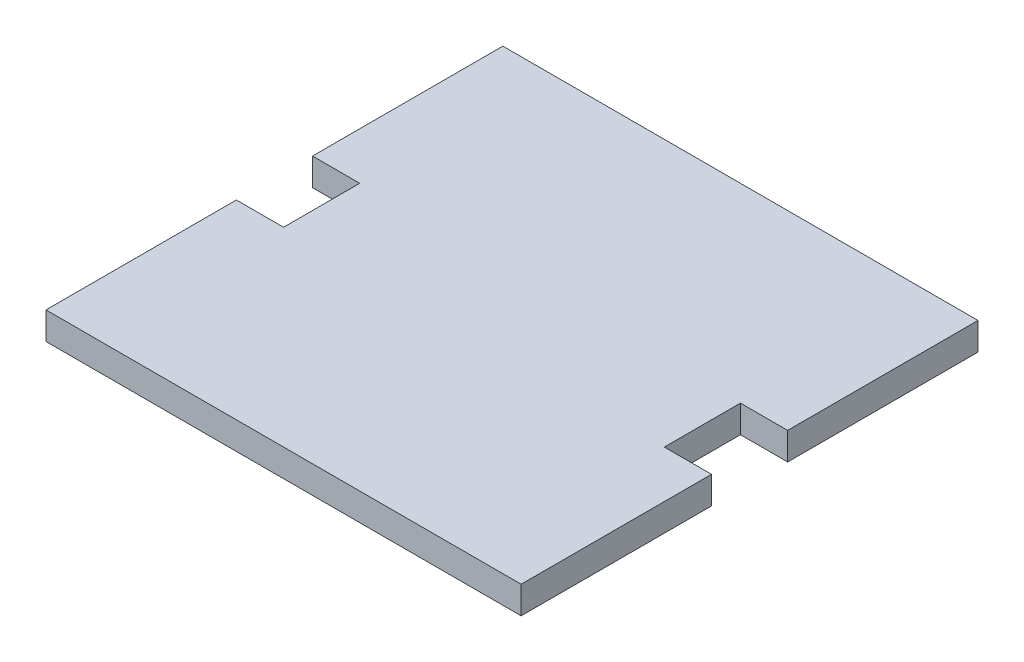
SolidWorks part; units mm, degrees
ref_plane "Front Plane" through (0, 0, 0) normal (0, 0, 1) x (1, 0, 0)
ref_plane "Top Plane" through (0, 0, 0) normal (0, 1, 0) x (1, 0, 0)
ref_plane "Right Plane" through (0, 0, 0) normal (1, 0, 0) x (0, 0, -1)
sketch "Sketch1" plane through (0, 0, 0) normal (0, 1, 0) x (1, 0, 0)
  line L0 (-156, 0) -> (156, 0) construction
  line L1 (-156, 150) -> (156, 150)
  line L2 (-156, 150) -> (-156, 25)
  line L3 (-156, -150) -> (156, -150)
  line L4 (156, 150) -> (156, 25)
  line L5 (0, 150) -> (0, -150) construction
  line L6 (156, -25) -> (125, -25)
  line L7 (-156, -25) -> (-125, -25)
  line L8 (156, -25) -> (156, -150)
  line L9 (-156, 25) -> (-125, 25)
  line L10 (-125, -25) -> (-125, 25)
  line L11 (156, 25) -> (125, 25)
  line L12 (125, -25) -> (125, 25)
  line L13 (-156, -25) -> (-156, -150)
  dimension "D1" = 300
  dimension "D2" = 312
  dimension "D3" = 50
  dimension "D4" = 31
extrude "Extrude1" add sketch "Sketch1" along normal blind 18
